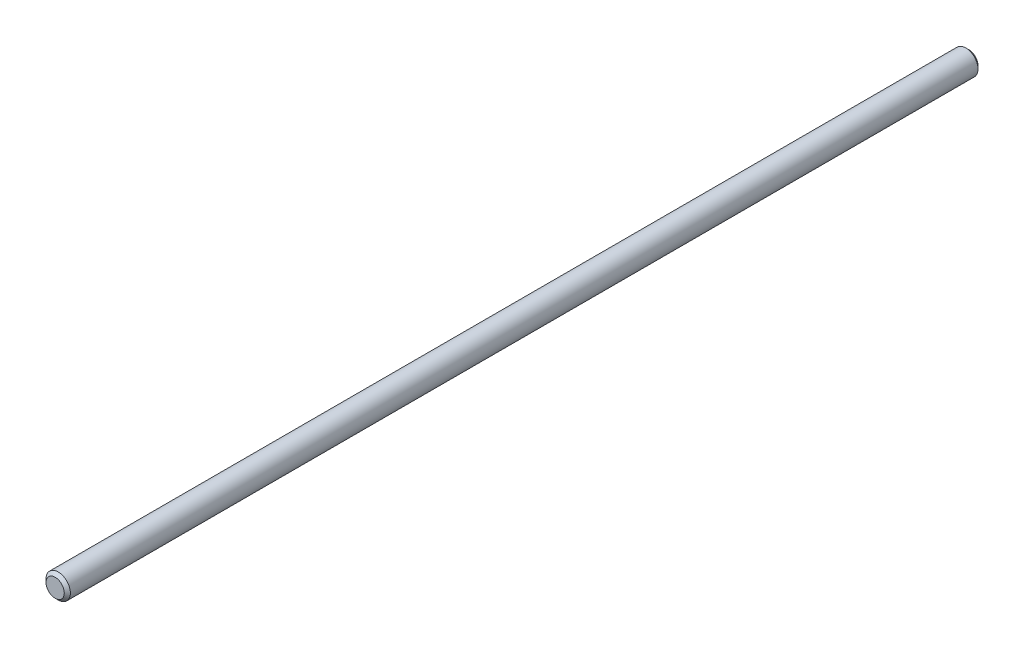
SolidWorks part; units mm, degrees
ref_plane "前视基准面" through (0, 0, 0) normal (0, 0, 1) x (1, 0, 0)
ref_plane "上视基准面" through (0, 0, 0) normal (0, 1, 0) x (1, 0, 0)
ref_plane "右视基准面" through (0, 0, 0) normal (1, 0, 0) x (0, 0, -1)
sketch "草图1" plane through (0, 0, 0) normal (0, 0, 1) x (1, 0, 0)
  circle A0 centre (0, 0) radius 2
extrude "凸台-拉伸1" add sketch "草图1" against normal blind 150
chamfer "倒角1" distance 0.5 angle 45 2 edges at (2, 0, -150) (2, 0, 0)
